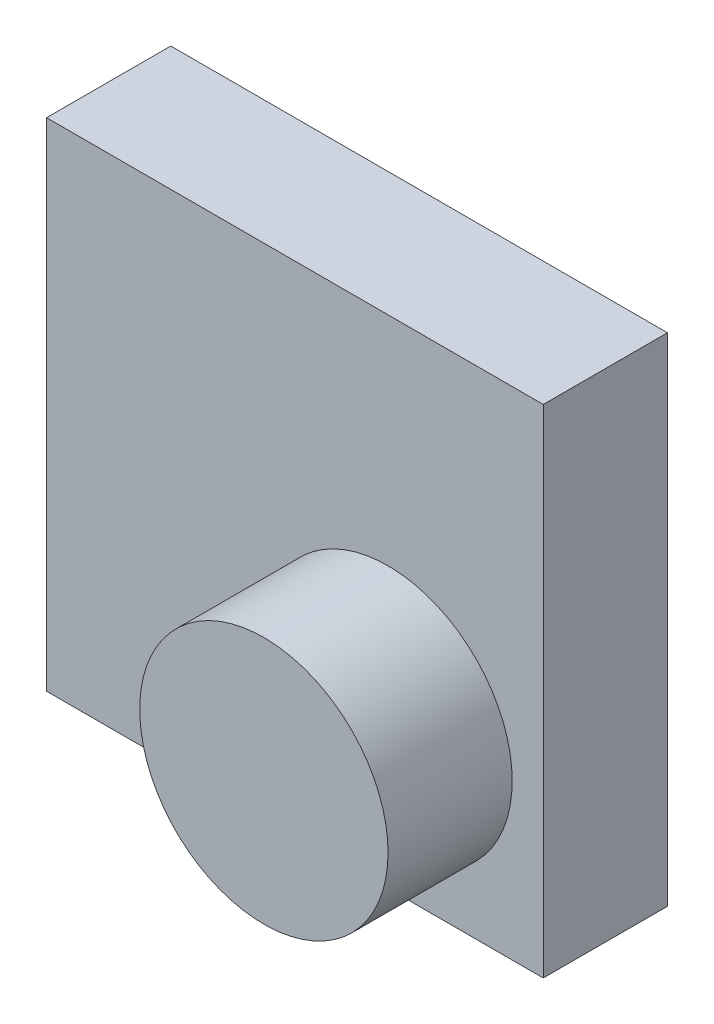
SolidWorks part; units mm, degrees
ref_plane "Front Plane" through (0, 0, 0) normal (0, 0, 1) x (1, 0, 0)
ref_plane "Top Plane" through (0, 0, 0) normal (0, 1, 0) x (1, 0, 0)
ref_plane "Right Plane" through (0, 0, 0) normal (1, 0, 0) x (0, 0, -1)
sketch "Sketch1" plane through (0, 0, 0) normal (0, 0, 1) x (1, 0, 0)
  line L1 (-50.8, 50.8) -> (50.8, 50.8)
  line L2 (-50.8, 50.8) -> (-50.8, -50.8)
  line L3 (-50.8, -50.8) -> (50.8, -50.8)
  line L4 (50.8, 50.8) -> (50.8, -50.8)
  dimension "D1" = 101.6
  dimension "D2" = 101.6
  dimension "D3" = 50.8
  dimension "D4" = 50.8
extrude "Boss-Extrude1" add sketch "Sketch1" along normal mid plane 25.4
sketch "Sketch3" plane through (0, 0, 12.7) normal (0, 0, 1) x (1, 0, 0)
  line L0 (-50.8, -50.8) -> (50.8, -50.8) construction
  line L1 (50.8, -50.8) -> (50.8, 50.8) construction
  circle A0 centre (19.05, -19.05) radius 25.4
  dimension "D1" = 50.8
  dimension "D2" = 31.75
  dimension "D3" = 31.75
extrude "Boss-Extrude2" add sketch "Sketch3" along normal blind 25.4 contours A0
